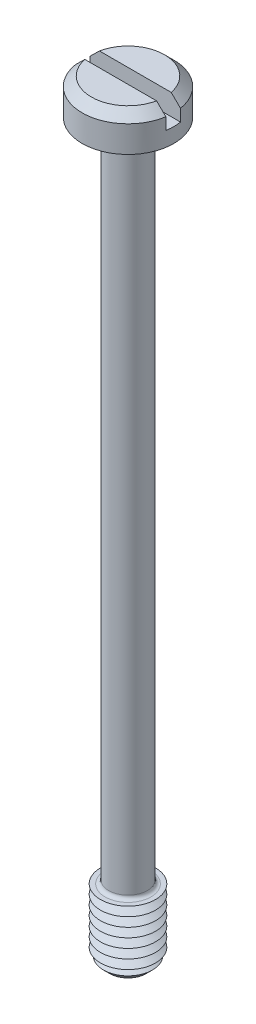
SolidWorks part; units mm, degrees
ref_plane "Front Plane" through (0, 0, 0) normal (0, 0, 1) x (1, 0, 0)
ref_plane "Top Plane" through (0, 0, 0) normal (0, 1, 0) x (1, 0, 0)
ref_plane "Right Plane" through (0, 0, 0) normal (1, 0, 0) x (0, 0, -1)
sketch "Sketch1" plane through (0, 0, 0) normal (0, 1, 0) x (1, 0, 0)
  circle A0 centre (0, 0) radius 5
  dimension "D1" = 10
extrude "Boss-Extrude1" add sketch "Sketch1" along normal blind 3.9
sketch "Sketch2" plane through (0, 0, 0) normal (0, -1, 0) x (1, 0, 0)
  circle A0 centre (0, 0) radius 2.1
  dimension "D1" = 4.2
extrude "Boss-Extrude2" add sketch "Sketch2" along normal blind 80
sketch "Sketch3" plane through (0, -80, 0) normal (0, -1, 0) x (1, 0, 0)
  circle A0 centre (0, 0) radius 3
  dimension "D1" = 6
extrude "Boss-Extrude3" add sketch "Sketch3" against normal blind 7.5
chamfer "Chamfer1" distance 1 angle 45 1 edges at (0, -80, -3)
sketch "Sketch4" plane through (0, 0, 0) normal (1, 0, 0) x (0, 0, -1)
  line L0 (0, -6.5871) -> (0, -12.0372) construction
sketch "Sketch5" plane through (0, 0, 0) normal (1, 0, 0) x (0, 0, -1)
  line L0 (-3, -72.5) -> (-2.134, -73)
  line L1 (-2.134, -73) -> (-3, -73.5)
  line L2 (-3, -72.5) -> (-3, -79) construction
  line L3 (-3, -73.5) -> (-3, -72.5)
  dimension "D1" = 1
revolve "Cut-Revolve1" cut sketch "Sketch5" angle 360 about L0
pattern_linear "LPattern1" count 7 spacing 1 along (0, -1, 0) of "Cut-Revolve1"
fillet "Fillet1" radius 0.4 2 edges at (0, -72.5, -2.1) (0, 0, -2.1)
chamfer "Chamfer2" distance 1 angle 45 1 edges at (0, 3.9, 5)
sketch "Sketch6" plane through (0, 3.9, 0) normal (0, 1, 0) x (1, 0, 0)
  line L1 (5, -0.8) -> (-5, -0.8)
  line L2 (5, -0.8) -> (5, 0.8)
  line L3 (5, 0.8) -> (-5, 0.8)
  line L4 (-5, -0.8) -> (-5, 0.8)
  line L5 (5, -0.8) -> (-5, 0.8) construction
  line L6 (5, 0.8) -> (-5, -0.8) construction
  circle A0 centre (0, 0) radius 5 construction
  point P0 (0, 0)
  dimension "D1" = 1.6
extrude "Cut-Extrude1" cut sketch "Sketch6" against normal blind 2.3
